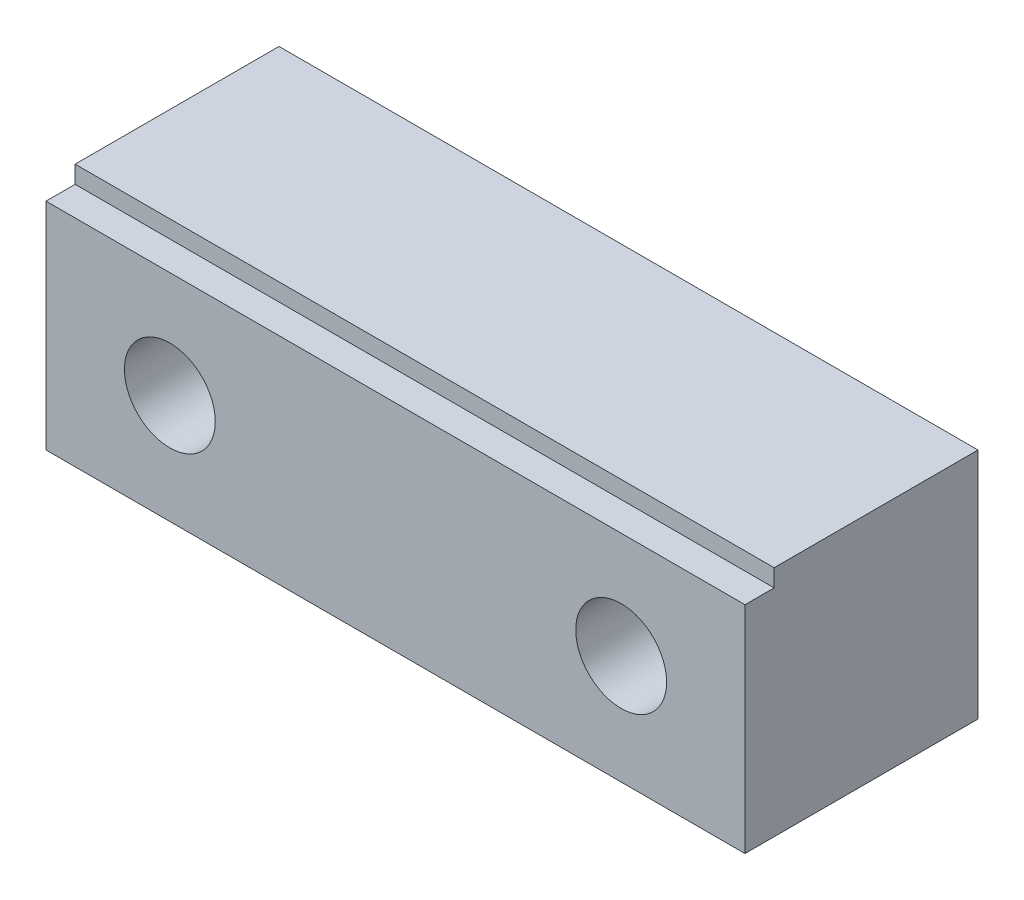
SolidWorks part; units mm, degrees
ref_plane "Front Plane" through (0, 0, 0) normal (0, 0, 1) x (1, 0, 0)
ref_plane "Top Plane" through (0, 0, 0) normal (0, 1, 0) x (1, 0, 0)
ref_plane "Right Plane" through (0, 0, 0) normal (1, 0, 0) x (0, 0, -1)
sketch "Sketch1" plane through (0, 0, 0) normal (0, 1, 0) x (1, 0, 0)
  line L1 (-76.2, 25.4) -> (76.2, 25.4)
  line L2 (-76.2, 25.4) -> (-76.2, -25.4)
  line L3 (-76.2, -25.4) -> (76.2, -25.4)
  line L4 (76.2, 25.4) -> (76.2, -25.4)
  line L5 (-76.2, 25.4) -> (76.2, -25.4) construction
  line L6 (-76.2, -25.4) -> (76.2, 25.4) construction
  point P0 (0, 0)
  dimension "D1" = 50.8
  dimension "D2" = 152.4
extrude "Boss-Extrude1" add sketch "Sketch1" against normal blind 50.8
sketch "Sketch2" plane through (0, 0, 25.4) normal (0, 0, 1) x (1, 0, 0)
  line L0 (-76.2, -50.8) -> (-76.2, 0) construction
  line L1 (-76.2, -50.8) -> (76.2, -50.8) construction
  line L2 (0, 0) -> (0, -65.8424) construction
  circle A0 centre (-49.1998, -27.0002) radius 9.906
  circle A1 centre (49.1998, -27.0002) radius 9.906
  dimension "D3" = 19.812
  dimension "D1" = 27.0002
  dimension "D2" = 23.7998
extrude "Cut-Extrude1" cut sketch "Sketch2" against normal offset from surface (41.402 mm away) 9.398
sketch "Sketch3" plane through (0, 0, 25.4) normal (0, 0, 1) x (1, 0, 0)
  circle A0 centre (-49.1998, -27.0002) radius 6.7437
  circle A1 centre (49.1998, -27.0002) radius 6.7437
  dimension "D1" = 13.4874
extrude "Cut-Extrude2" cut sketch "Sketch3" against normal through all
sketch "Sketch4" plane through (76.2, 0, 0) normal (1, 0, 0) x (0, 0, -1)
  line L1 (-25.4, 0) -> (-19.05, 0)
  line L2 (-25.4, 0) -> (-25.4, -3.81)
  line L3 (-25.4, -3.81) -> (-19.05, -3.81)
  line L4 (-19.05, 0) -> (-19.05, -3.81)
  dimension "D1" = 6.35
  dimension "D2" = 3.81
extrude "Cut-Extrude3" cut sketch "Sketch4" against normal through all
